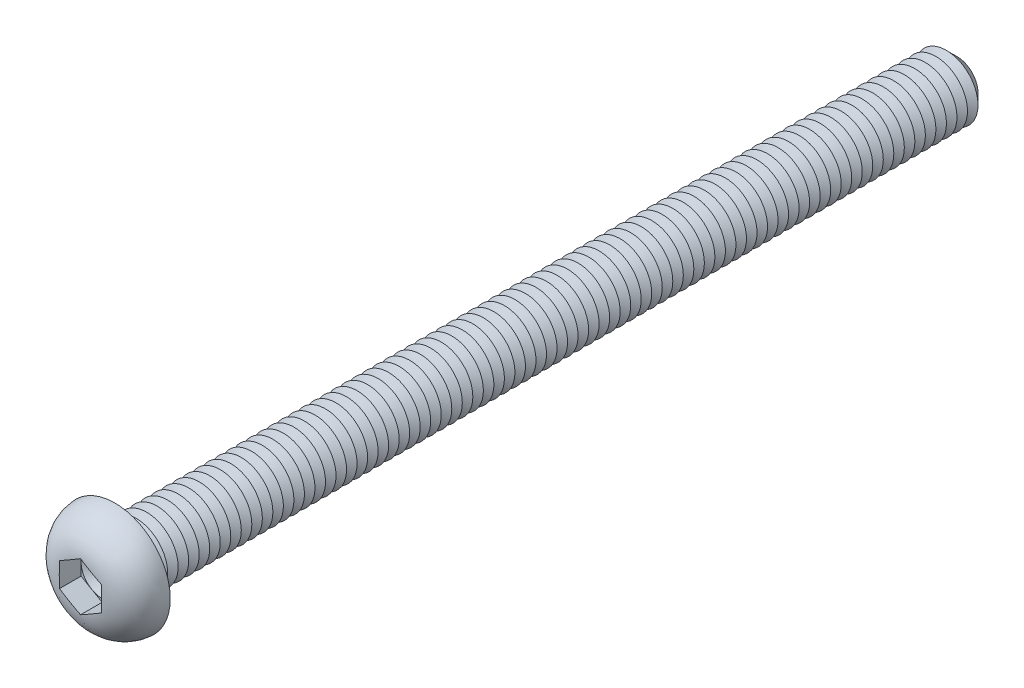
SolidWorks part; units mm, degrees
ref_plane "Front Plane" through (0, 0, 0) normal (0, 0, 1) x (1, 0, 0)
ref_plane "Top Plane" through (0, 0, 0) normal (0, 1, 0) x (1, 0, 0)
ref_plane "Right Plane" through (0, 0, 0) normal (1, 0, 0) x (0, 0, -1)
sketch "Sketch1" plane through (0, 0, 0) normal (1, 0, 0) x (0, 0, -1)
  line L0 (-47.9342, 0) -> (60.3146, 0) construction
sketch "Sketch2" plane through (0, 0, 0) normal (1, 0, 0) x (0, 0, -1)
  line L0 (0, 0) -> (-3.3, 0)
  line L1 (-47.9342, 0) -> (60.3146, 0) construction
  line L2 (-3.3, 0) -> (-3.3, 1.8515)
  line L3 (0, 5.25) -> (0, 0)
  arc A0 (-3.3, 1.8515) -> (0, 5.25) centre (0.1, 1.8515) cw
  dimension "D1" = 3.4
  dimension "D2" = 3.3
  dimension "D3" = 5.25
revolve "Revolve1" add sketch "Sketch2" angle 360 about L0
sketch "Sketch3" plane through (0, 0, 3.3) normal (0, 0, 1) x (1, 0, 0)
  line L1 (0, 2.3094) -> (-2, 1.1547)
  line L2 (-2, 1.1547) -> (-2, -1.1547)
  line L3 (-2, -1.1547) -> (0, -2.3094)
  line L4 (0, -2.3094) -> (2, -1.1547)
  line L5 (2, -1.1547) -> (2, 1.1547)
  line L6 (2, 1.1547) -> (0, 2.3094)
  circle A0 centre (0, 0) radius 2 construction
  dimension "D1" = 4
extrude "Cut-Extrude1" cut sketch "Sketch3" against normal blind 2.08
sketch "Sketch4" plane through (0, 0, 0) normal (0, 0, -1) x (-1, 0, 0)
  circle A0 centre (0, 0) radius 3
  dimension "D1" = 6
extrude "Boss-Extrude1" add sketch "Sketch4" along normal blind 80
chamfer "Chamfer1" distance 1 angle 45 1 edges at (-3, 0, -80)
sketch "Sketch5" plane through (0, 0, 0) normal (1, 0, 0) x (0, 0, -1)
  line L0 (1, 3) -> (2, 3)
  line L1 (79, 3) -> (0, 3) construction
  line L2 (2, 3) -> (1.5, 2.134)
  line L3 (1.5, 2.134) -> (1, 3)
  line L4 (0, -5.25) -> (0, 5.25) construction
  line L5 (79, 3) -> (0, 3) construction
  dimension "D1" = 1
  dimension "D2" = 1
revolve "Cut-Revolve1" cut sketch "Sketch5" angle 360 about L0
pattern_linear "LPattern1" count 78 spacing 1 along (0, 0, -1) of "Cut-Revolve1"
fillet "Fillet2" radius 0.4 1 edges at (-3, 0, 0)
sketch "Sketch6" plane through (0, 0, 1.22) normal (0, 0, 1) x (1, 0, 0)
  line L0 (0, -2.3094) -> (2, -1.1547) construction
  circle A0 centre (0, 0) radius 2
extrude "Cut-Extrude2" cut sketch "Sketch6" against normal through all draft 60
